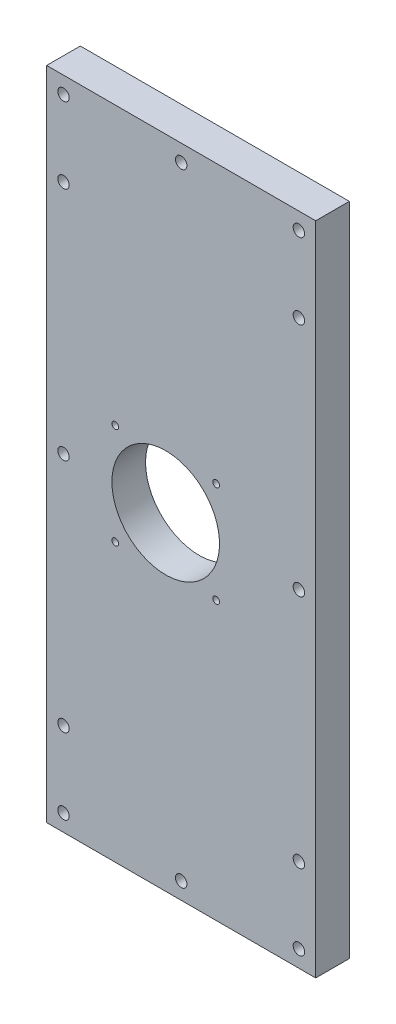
SolidWorks part; units mm, degrees
ref_plane "Ebene vorne" through (0, 0, 0) normal (0, 0, 1) x (1, 0, 0)
ref_plane "Ebene oben" through (0, 0, 0) normal (0, 1, 0) x (1, 0, 0)
ref_plane "Ebene rechts" through (0, 0, 0) normal (1, 0, 0) x (0, 0, -1)
sketch "Skizze1" plane through (0, 0, 0) normal (0, 0, 1) x (1, 0, 0)
  line L1 (-69.0594, 70.0995) -> (10.9406, 70.0995)
  line L2 (-69.0594, 70.0995) -> (-69.0594, -124.9005)
  line L3 (-69.0594, -124.9005) -> (10.9406, -124.9005)
  line L4 (10.9406, 70.0995) -> (10.9406, -124.9005)
  dimension "D1" = 195
  dimension "D2" = 80
extrude "Aufsatz-Linear austragen1" add sketch "Skizze1" against normal blind 10
sketch "Skizze2" plane through (0, 0, -10) normal (0, 0, -1) x (-1, 0, 0)
  line L0 (33.6594, 70.0995) -> (33.6594, -124.9005) construction
  line L1 (-10.9406, 70.0995) -> (69.0594, 70.0995) construction
  line L2 (69.0594, -124.9005) -> (-10.9406, -124.9005) construction
  line L3 (33.6594, -27.4005) -> (69.0594, -27.4005) construction
  line L4 (69.0594, 70.0995) -> (69.0594, -124.9005) construction
  line L5 (18.6594, -12.4005) -> (48.6594, -12.4005) construction
  line L6 (48.6594, -12.4005) -> (48.6594, -42.4005) construction
  line L7 (48.6594, -42.4005) -> (18.6594, -42.4005) construction
  line L8 (18.6594, -42.4005) -> (18.6594, -12.4005) construction
  line L9 (18.6594, -12.4005) -> (48.6594, -42.4005) construction
  circle A0 centre (18.6594, -12.4005) radius 1
  circle A1 centre (48.6594, -12.4005) radius 1
  circle A2 centre (18.6594, -42.4005) radius 1
  circle A3 centre (48.6594, -42.4005) radius 1
  circle A4 centre (33.6594, -27.4005) radius 16
  point P22 (33.6594, -27.4005)
  dimension "D1" = 30
  dimension "D3" = 2
  dimension "D2" = 30
  dimension "D4" = 35.4
extrude "Schnitt-Linear austragen1" cut sketch "Skizze2" against normal blind 10
sketch "Skizze3" plane through (0, 0, -10) normal (0, 0, -1) x (-1, 0, 0)
  line L0 (-5.9406, 65.0995) -> (64.0594, 65.0995) construction
  line L1 (29.0594, 65.0995) -> (29.0594, 70.0995) construction
  line L2 (-10.9406, 70.0995) -> (69.0594, 70.0995) construction
  line L3 (69.0594, 70.0995) -> (69.0594, -124.9005) construction
  line L4 (-5.9406, -119.9005) -> (64.0594, -119.9005) construction
  line L5 (29.0594, -119.9005) -> (29.0594, -124.9005) construction
  line L6 (69.0594, -124.9005) -> (-10.9406, -124.9005) construction
  line L7 (-5.9406, 42.5995) -> (-5.9406, -27.4005) construction
  line L8 (-5.9406, 42.5995) -> (-5.9406, 65.0995) construction
  line L9 (-5.9406, -27.4005) -> (-5.9406, -97.4005) construction
  line L10 (64.0594, 42.5995) -> (64.0594, 65.0995) construction
  line L11 (64.0594, -97.4005) -> (64.0594, -27.4005) construction
  line L12 (-5.9406, -97.4005) -> (-5.9406, -119.9005) construction
  line L13 (64.0594, -97.4005) -> (64.0594, -119.9005) construction
  line L15 (64.0594, -27.4005) -> (64.0594, 42.5995) construction
  circle A0 centre (29.0594, 65.0995) radius 3.5
  circle A1 centre (-5.9406, 65.0995) radius 3.5
  circle A2 centre (64.0594, 65.0995) radius 3.5
  circle A3 centre (29.0594, -119.9005) radius 3.5
  circle A4 centre (-5.9406, -119.9005) radius 3.5
  circle A5 centre (64.0594, -119.9005) radius 3.5
  circle A6 centre (-5.9406, 42.5995) radius 3.5
  circle A7 centre (-5.9406, -27.4005) radius 3.5
  circle A9 centre (-5.9406, -97.4005) radius 3.5
  circle A10 centre (64.0594, -97.4005) radius 3.5
  circle A12 centre (64.0594, -27.4005) radius 3.5
  circle A13 centre (64.0594, 42.5995) radius 3.5
  dimension "D3" = 7
  dimension "D1" = 5
  dimension "D2" = 5
  dimension "D4" = 70
extrude "Schnitt-Linear austragen2" cut sketch "Skizze3" against normal blind 5
sketch "Skizze6" plane through (0, 0, 0) normal (0, 0, 1) x (1, 0, 0)
  line L0 (-64.0594, 65.0995) -> (-64.0594, 42.5995) construction
  line L1 (10.9406, -124.9005) -> (10.9406, 70.0995) construction
  line L2 (-64.0594, 42.5995) -> (-64.0594, -27.4005) construction
  line L3 (-64.0594, -27.4005) -> (-64.0594, -97.4005) construction
  line L4 (-64.0594, -97.4005) -> (-64.0594, -119.9005) construction
  line L5 (-64.0594, 65.0995) -> (5.9406, 65.0995) construction
  line L6 (5.9406, -119.9005) -> (5.9406, -97.4005) construction
  line L7 (5.9406, -97.4005) -> (5.9406, -27.4005) construction
  line L8 (5.9406, -27.4005) -> (5.9406, 42.5995) construction
  line L10 (5.9406, 42.5995) -> (5.9406, 65.0995) construction
  line L11 (-64.0594, -119.9005) -> (5.9406, -119.9005) construction
  line L12 (10.9406, 70.0995) -> (-69.0594, 70.0995) construction
  line L14 (-29.0594, 65.0995) -> (-29.0594, 70.0995) construction
  line L15 (-69.0594, -124.9005) -> (10.9406, -124.9005) construction
  circle A0 centre (-64.0594, 65.0995) radius 1.7
  circle A1 centre (-29.0594, 65.0995) radius 1.7
  circle A2 centre (5.9406, 65.0995) radius 1.7
  circle A3 centre (-64.0594, 42.5995) radius 1.7
  circle A5 centre (-64.0594, -27.4005) radius 1.7
  circle A6 centre (-64.0594, -97.4005) radius 1.7
  circle A7 centre (-64.0594, -119.9005) radius 1.7
  circle A8 centre (5.9406, -119.9005) radius 1.7
  circle A9 centre (5.9406, -97.4005) radius 1.7
  circle A10 centre (5.9406, -27.4005) radius 1.7
  circle A12 centre (5.9406, 42.5995) radius 1.7
  circle A13 centre (-29.0594, -119.9005) radius 1.7
  dimension "D2" = 3.4
  dimension "D1" = 5
  dimension "D3" = 5
  dimension "D4" = 70
  dimension "D5" = 5
extrude "Schnitt-Linear austragen4" cut sketch "Skizze6" against normal blind 5
